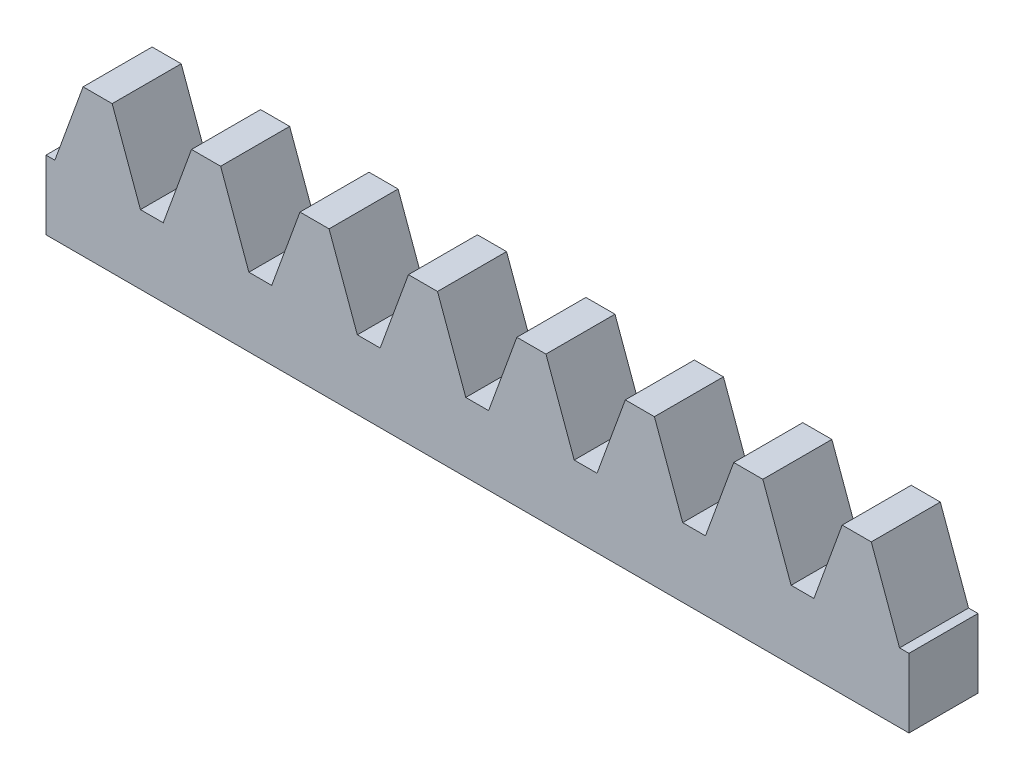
SolidWorks part; units mm, degrees
ref_plane "Front Plane" through (0, 0, 0) normal (0, 0, 1) x (1, 0, 0)
ref_plane "Top Plane" through (0, 0, 0) normal (0, 1, 0) x (1, 0, 0)
ref_plane "Right Plane" through (0, 0, 0) normal (1, 0, 0) x (0, 0, -1)
imported_body "Imported1"
sketch "Esquisse1" plane through (0, 100, 0) normal (0, 1, 0) x (1, 0, 0)
  line L0 (0, -50) -> (0, 50) construction
  line L1 (1704.9579, 83.6276) -> (250, 83.6276)
  line L2 (1704.9579, 83.6276) -> (1704.9579, -263.9084)
  line L3 (1704.9579, -263.9084) -> (250, -263.9084)
  line L4 (250, 83.6276) -> (250, -263.9084)
  dimension "D1" = 250
extrude "Enlèv. mat.-Extru.1" cut sketch "Esquisse1" against normal through all
sketch "Esquisse2" plane through (0, 0, 50) normal (0, 0, 1) x (1, 0, 0)
  line L0 (33.9702, 77.5) -> (27.3616, 77.5) construction
  line L1 (0, 0) -> (260.2605, 0)
  line L2 (0, 0) -> (0, 57.5)
  line L3 (0, 57.5) -> (260.2605, 57.5)
  line L4 (260.2605, 0) -> (260.2605, 57.5)
  dimension "D1" = 20
extrude "Enlèv. mat.-Extru.2" cut sketch "Esquisse2" against normal through all
sketch "Esquisse3" plane through (0, 57.5, 0) normal (0, -1, 0) x (1, 0, 0)
  line L0 (250, 50) -> (250, -50) construction
  line L1 (0, 50) -> (250, 50)
  line L2 (0, 50) -> (0, -30)
  line L3 (0, -30) -> (250, -30)
  line L4 (250, 50) -> (250, -30)
  dimension "D1" = 80
extrude "Enlèv. mat.-Extru.3" cut sketch "Esquisse3" against normal through all
